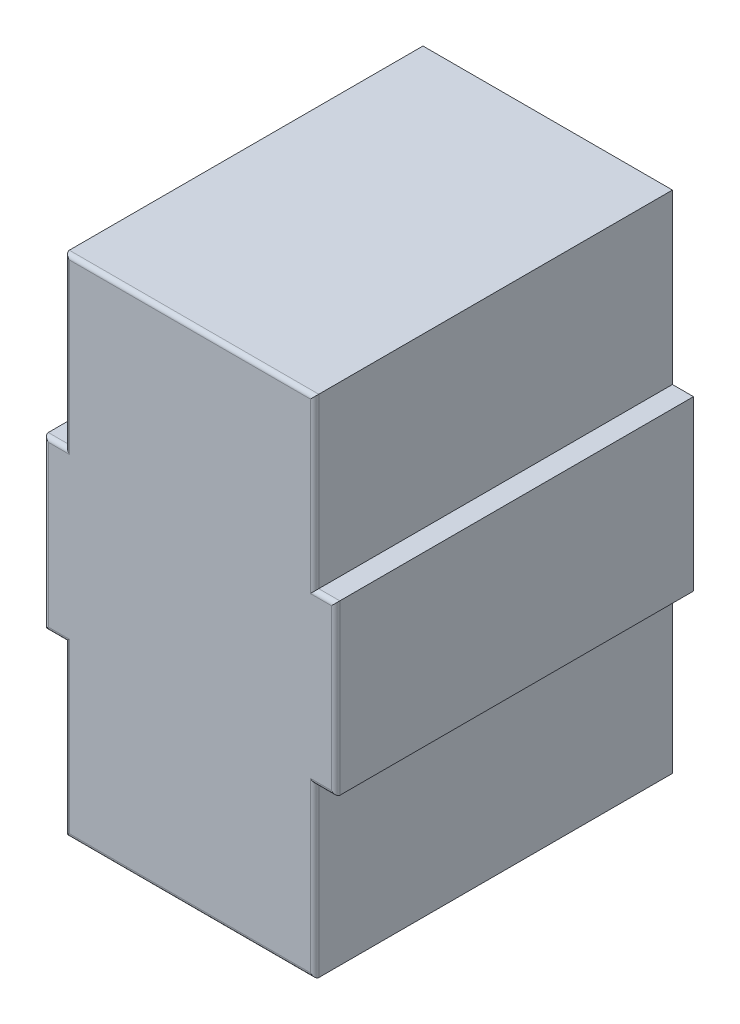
SolidWorks part; units mm, degrees
ref_plane "Plan de face" through (0, 0, 0) normal (0, 0, 1) x (1, 0, 0)
ref_plane "Plan de dessus" through (0, 0, 0) normal (0, 1, 0) x (1, 0, 0)
ref_plane "Plan de droite" through (0, 0, 0) normal (1, 0, 0) x (0, 0, -1)
sketch "Esquisse1" plane through (0, 0, 0) normal (0, 0, 1) x (1, 0, 0)
  line L0 (12.85, 0) -> (12.85, 8)
  line L1 (1, 0) -> (12.85, 0)
  line L2 (0, 8) -> (0, 16)
  line L3 (1, 24) -> (12.85, 24)
  line L4 (13.85, 8) -> (13.85, 16)
  line L5 (1, 0) -> (1, 8)
  line L7 (13.85, 16) -> (12.85, 16)
  line L8 (13.85, 8) -> (12.85, 8)
  line L9 (13.85, 0) -> (13.85, 24) construction
  line L10 (12.85, 16) -> (12.85, 24)
  line L11 (12.85, 0) -> (12.85, 24) construction
  line L12 (0, 0) -> (0, 24) construction
  line L13 (1, 16) -> (1, 24)
  line L14 (1, 0) -> (1, 24) construction
  line L15 (1, 16) -> (0, 16)
  line L17 (1, 8) -> (0, 8)
  dimension "D3" = 1
  dimension "D4" = 1
extrude "Extrusion1" add sketch "Esquisse1" along normal blind 17
fillet "Congé1" radius 0.2 12 edges at (1, 4, 17) (0.5, 8, 17) (0, 12, 17) (0.5, 16, 17) (1, 20, 17) (6.925, 24, 17) (12.85, 20, 17) (13.35, 16, 17) (13.85, 12, 17) (13.35, 8, 17) (12.85, 4, 17) (6.925, 0, 17)
